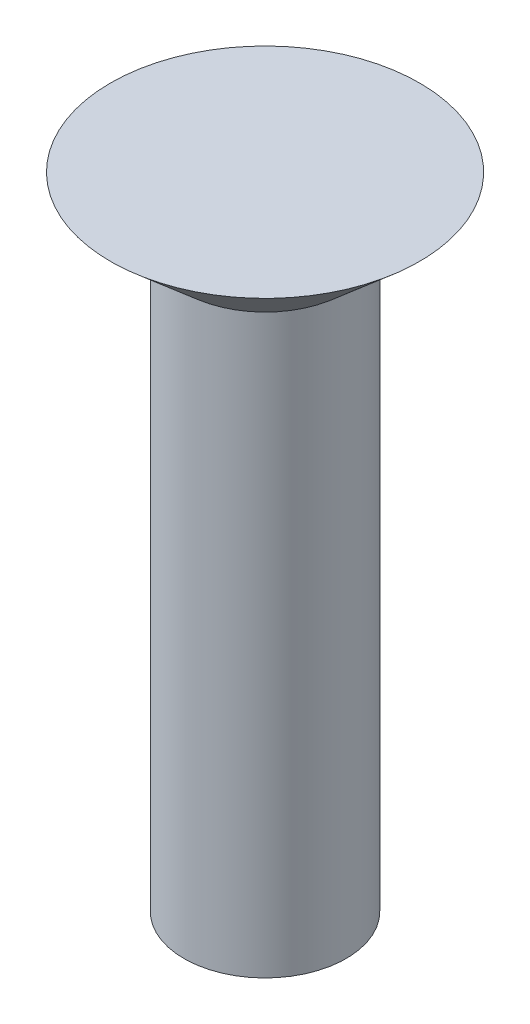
SolidWorks part; units mm, degrees
ref_plane "Front Plane" through (0, 0, 0) normal (0, 0, 1) x (1, 0, 0)
ref_plane "Top Plane" through (0, 0, 0) normal (0, 1, 0) x (1, 0, 0)
ref_plane "Right Plane" through (0, 0, 0) normal (1, 0, 0) x (0, 0, -1)
sketch "Sketch1" plane through (0, 0, 0) normal (0, 0, 1) x (1, 0, 0)
  line L0 (0, 0) -> (0, -19.05) construction
  line L1 (0, 0) -> (4.5974, 0)
  line L2 (4.5974, 0) -> (2.413, -1.8989)
  line L3 (2.413, -1.8989) -> (2.413, -19.05)
  line L4 (2.413, -19.05) -> (0, -19.05)
  line L5 (0, 0) -> (0, -19.05)
  dimension "D1" = 9.1948
  dimension "D2" = 4.826
  dimension "D3" = 41
  dimension "D4" = 19.05
revolve "Revolve1" add sketch "Sketch1" angle 360 about L0
